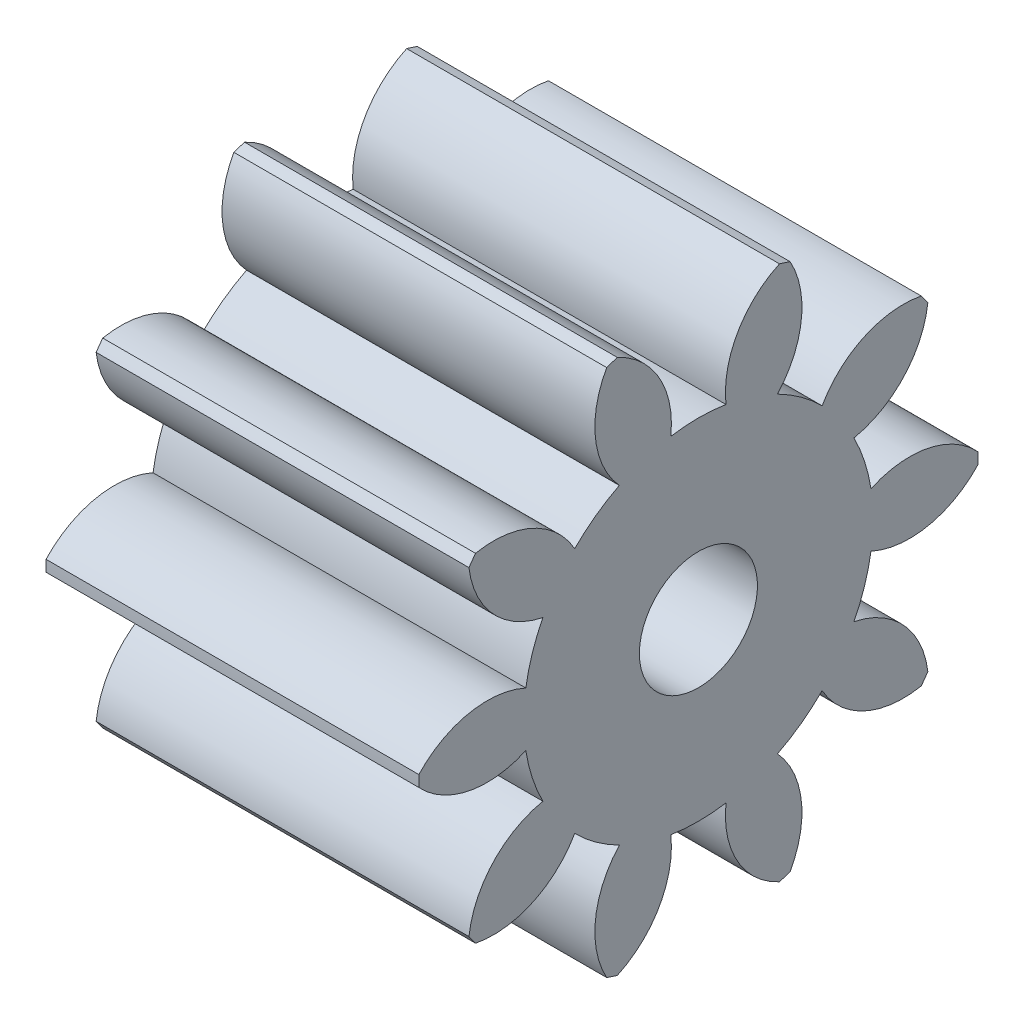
SolidWorks part; units mm, degrees
ref_plane "Alzado" through (0, 0, 0) normal (0, 0, 1) x (1, 0, 0)
ref_plane "Planta" through (0, 0, 0) normal (0, 1, 0) x (1, 0, 0)
ref_plane "Vista lateral" through (0, 0, 0) normal (1, 0, 0) x (0, 0, -1)
imported_body "spur gear_din-1-solid1"
sketch "Croquis1" plane through (-6.0287, 0, 0) normal (-1, 0, 0) x (0, 0, 1)
  circle A0 centre (0, 1.0506) radius 0.95
  dimension "D1" = 1.9
extrude "Cortar-Extruir1" cut sketch "Croquis1" against normal through all both and the other way through all
